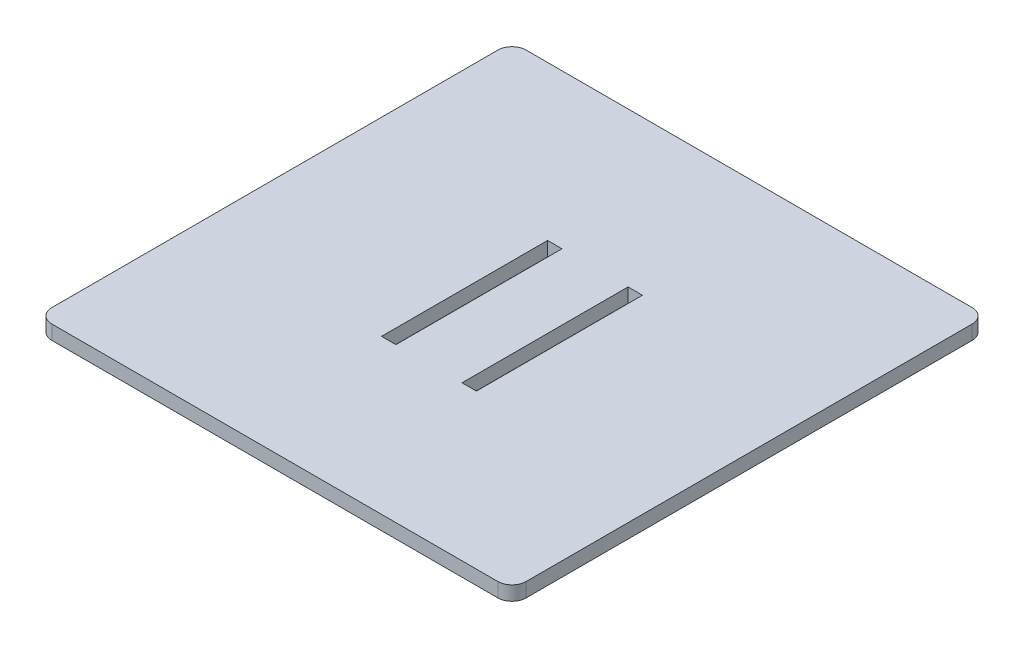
SolidWorks part; units mm, degrees
ref_plane "Ön Düzlem" through (0, 0, 0) normal (0, 0, 1) x (1, 0, 0)
ref_plane "Üst Düzlem" through (0, 0, 0) normal (0, 1, 0) x (1, 0, 0)
ref_plane "Sağ Düzlem" through (0, 0, 0) normal (1, 0, 0) x (0, 0, -1)
sketch "Çizim1" plane through (0, 0, 0) normal (0, 1, 0) x (1, 0, 0)
  line L1 (-100, 100) -> (100, 100)
  line L2 (-100, 100) -> (-100, -100)
  line L3 (-100, -100) -> (100, -100)
  line L4 (100, 100) -> (100, -100)
  line L5 (-100, 100) -> (100, -100) construction
  line L6 (-100, -100) -> (100, 100) construction
  line L7 (-20, 35) -> (-13.93, 35)
  line L8 (-20, 35) -> (-20, -35)
  line L9 (-20, -35) -> (-13.93, -35)
  line L10 (-13.93, 35) -> (-13.93, -35)
  line L11 (20, -35) -> (13.93, -35)
  line L12 (20, -35) -> (20, 35)
  line L13 (20, 35) -> (13.93, 35)
  line L14 (13.93, -35) -> (13.93, 35)
  point P0 (0, 0)
  dimension "D1" = 200
  dimension "D2" = 200
  dimension "D3" = 70
  dimension "D4" = 6.07
  dimension "D5" = 80
  dimension "D6" = 70
  dimension "D7" = 6.07
  dimension "D8" = 80
  dimension "D9" = 65
  dimension "D10" = 65
  dimension "D11" = 27.86
extrude "Yükseklik-Ekstrüzyon1" add sketch "Çizim1" along normal blind 6
fillet "Radyus1" radius 6 4 edges at (100, 3, -100) (-100, 3, -100) (-100, 3, 100) (100, 3, 100)
